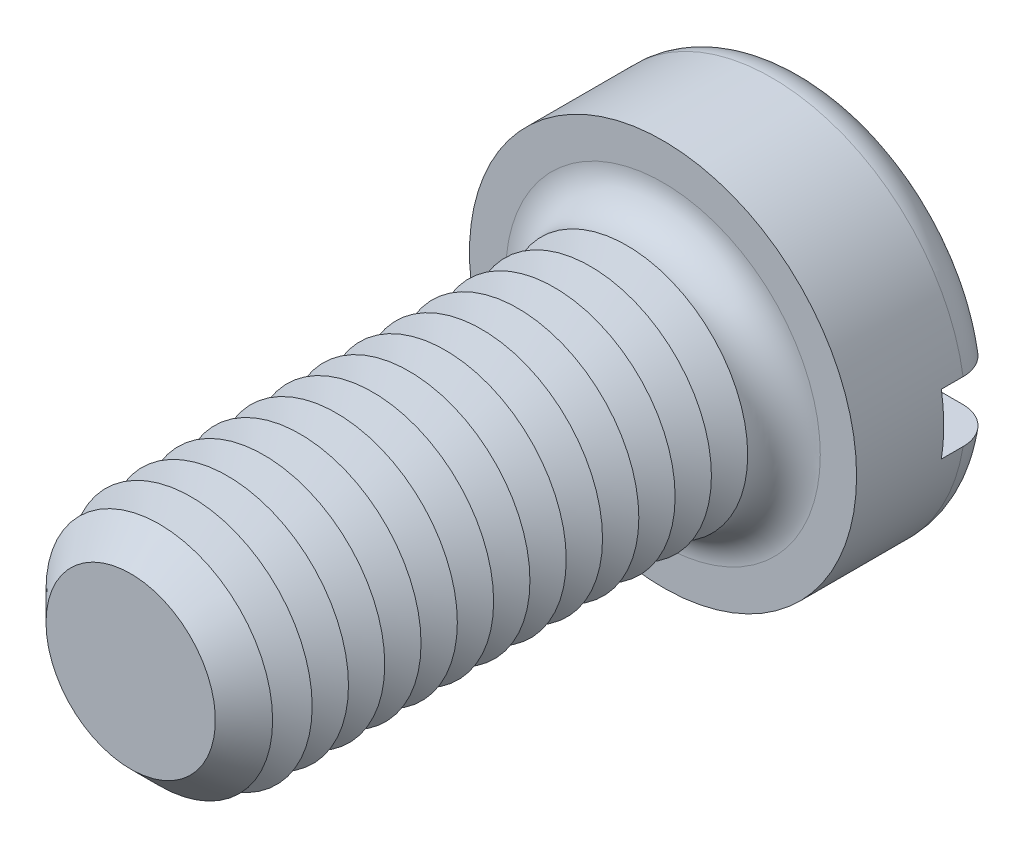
SolidWorks part; units mm, degrees
ref_plane "Front Plane" through (0, 0, 0) normal (0, 0, 1) x (1, 0, 0)
ref_plane "Top Plane" through (0, 0, 0) normal (0, 1, 0) x (1, 0, 0)
ref_plane "Right Plane" through (0, 0, 0) normal (1, 0, 0) x (0, 0, -1)
sketch "Sketch3" plane through (0, 0, 0) normal (0, 0, 1) x (1, 0, 0)
  circle A0 centre (0, 0) radius 8
  dimension "D1" = 16
extrude "Boss-Extrude2" add sketch "Sketch3" against normal blind 6
sketch "Sketch4" plane through (0, 0, 0) normal (0, 0, 1) x (1, 0, 0)
  circle A0 centre (0, 0) radius 5
  dimension "D1" = 10
extrude "Boss-Extrude3" add sketch "Sketch4" along normal blind 22
fillet "Fillet1" radius 1.5 2 edges at (8, 0, -6) (5, 0, 0)
chamfer "Chamfer1" distance 1.5 angle 45 1 edges at (5, 0, 22)
sketch "Sketch5" plane through (0, 0, 0) normal (1, 0, 0) x (0, 0, -1)
  line L0 (1.6944, 0) -> (-7.6738, 0) construction
sketch "Sketch6" plane through (0, 0, 0) normal (1, 0, 0) x (0, 0, -1)
  line L0 (-1.5, 5) -> (-2.25, 3.701)
  line L1 (-2.25, 3.701) -> (-3, 5)
  line L2 (-1.5, 5) -> (-20.5, 5) construction
  line L3 (-3, 5) -> (-1.5, 5)
  dimension "D1" = 1.5
revolve "Cut-Revolve1" cut sketch "Sketch6" angle 360 about L0
pattern_linear "LPattern1" count 13 spacing 1.5 along (0, 0, 1) of "Cut-Revolve1"
sketch "Sketch8" plane through (0, 0, -6) normal (0, 0, -1) x (-1, 0, 0)
  line L1 (8, -1.25) -> (-8, -1.25)
  line L2 (8, -1.25) -> (8, 1.25)
  line L3 (8, 1.25) -> (-8, 1.25)
  line L4 (-8, -1.25) -> (-8, 1.25)
  line L5 (8, -1.25) -> (-8, 1.25) construction
  line L6 (8, 1.25) -> (-8, -1.25) construction
  point P0 (0, 0)
  dimension "D1" = 16
  dimension "D2" = 2.5
extrude "Cut-Extrude1" cut sketch "Sketch8" against normal blind 2.4
